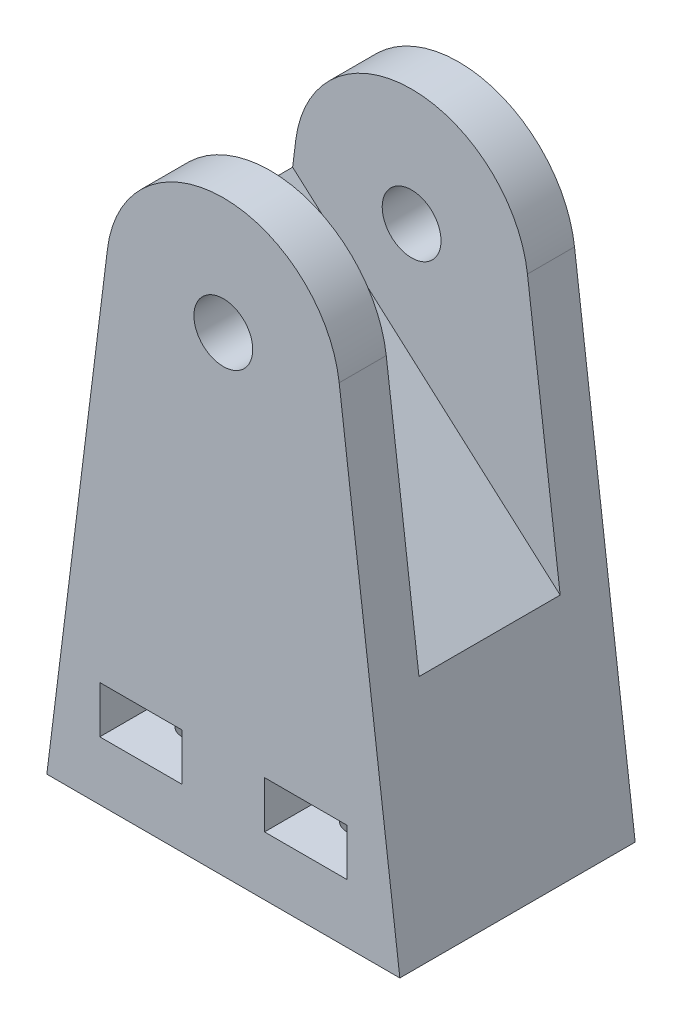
SolidWorks part; units mm, degrees
ref_plane "前视基准面" through (0, 0, 0) normal (0, 0, 1) x (1, 0, 0)
ref_plane "上视基准面" through (0, 0, 0) normal (0, 1, 0) x (1, 0, 0)
ref_plane "右视基准面" through (0, 0, 0) normal (1, 0, 0) x (0, 0, -1)
sketch "草图1" plane through (0, 0, 0) normal (0, 0, 1) x (1, 0, 0)
  line L0 (6, 20) -> (10, 20)
  line L1 (-10, 20) -> (-6, 20)
  line L3 (-10, -20) -> (10, -20)
  line L5 (0, -20) -> (15, -20)
  line L6 (15, -20) -> (10, 20)
  line L7 (-10, -20) -> (-15, -20)
  line L8 (-15, -20) -> (-10, 20)
  circle A0 centre (0, 20) radius 2.5
  arc A1 (6, 20) -> (-6, 20) centre (0, 20) ccw
extrude "凸台-拉伸1" add sketch "草图1" along normal blind 20 contours L0 A1 L1 L8 L7 L3 L5 L6 A0
fillet "圆角1" radius 10 2 edges at (-6, 20, 10) (6, 20, 10)
ref_plane "基准面1" through (0, 13, 0) normal (0, -1, 0) x (-1, 0, 0)
sketch "草图2" plane through (0, 13, 0) normal (0, -1, 0) x (-1, 0, 0)
  line L2 (15, 0) -> (-20.9192, 0)
  line L3 (15, 0) -> (15, -4)
  line L4 (15, -4) -> (-20.9192, -4)
  line L5 (-20.9192, 0) -> (-20.9192, -4)
  line L6 (15, -20) -> (-18.9377, -20)
  line L7 (15, -20) -> (15, -16)
  line L8 (15, -16) -> (-18.9377, -16)
  line L9 (-18.9377, -20) -> (-18.9377, -16)
  line L10 (15, -4) -> (-18.145, -4)
  line L11 (15, -4) -> (15, -8)
  line L12 (15, -8) -> (-18.145, -8)
  line L13 (-18.145, -4) -> (-18.145, -8)
  line L14 (15, -8) -> (-18.9377, -8)
  line L15 (15, -8) -> (15, -12)
  line L16 (15, -12) -> (-18.9377, -12)
  line L17 (-18.9377, -8) -> (-18.9377, -12)
  line L18 (15, -12) -> (-21.6756, -12)
  line L19 (15, -12) -> (15, -16)
  line L20 (15, -16) -> (-21.6756, -16)
  line L21 (-21.6756, -12) -> (-21.6756, -16)
extrude "切除-拉伸1" cut sketch "草图2" against normal blind 33 contours L4 L13 L12 L11 | L18 L21 L20 L8 L19 L16 | L14 L17 L16 L15 L12
sketch "草图6" plane through (0, 0, 20) normal (0, 0, 1) x (1, 0, 0)
  line L0 (-16.3849, -20) -> (-16.3849, -13)
  line L1 (15, -20) -> (-15, -20) construction
  line L2 (0, -13) -> (-7, -13)
  line L3 (-14.125, -13) -> (14.125, -13)
  line L4 (-15, -20) -> (-10, 20) construction
  line L5 (15, -20) -> (10, 20) construction
  line L6 (-7, -13) -> (7, -13)
  line L8 (-10, -11.5) -> (-4, -11.5)
  line L9 (-10, -11.5) -> (-10, -14.5)
  line L10 (-10, -14.5) -> (-4, -14.5)
  line L11 (-4, -11.5) -> (-4, -14.5)
  line L12 (-10, -11.5) -> (-4, -14.5) construction
  line L13 (-10, -14.5) -> (-4, -11.5) construction
  line L14 (4, -11.5) -> (10, -11.5)
  line L15 (4, -11.5) -> (4, -14.5)
  line L16 (4, -14.5) -> (10, -14.5)
  line L17 (10, -11.5) -> (10, -14.5)
  line L18 (4, -11.5) -> (10, -14.5) construction
  line L19 (4, -14.5) -> (10, -11.5) construction
extrude "切除-拉伸2" cut sketch "草图6" against normal through all contours L11 L6 L3 L9 L10 | L11 L8 L9 L3 L6 | L17 L3 L6 L15 L16 | L17 L14 L15 L6 L3
sketch "草图7" plane through (0, -20, 0) normal (0, -1, 0) x (1, 0, 0)
  line L0 (0, 20) -> (7, 20)
  line L1 (15, 20) -> (-15, 20) construction
  line L2 (7, 20) -> (-7, 20)
  line L3 (-7, 20) -> (-7, 0)
  line L4 (15, 0) -> (-15, 0) construction
  line L5 (-7, 10) -> (-7, 15)
  line L6 (-7, 10) -> (-7, 5)
  circle A0 centre (-7, 15) radius 1.5
  circle A1 centre (7, 15) radius 1.5
  circle A2 centre (-7, 5) radius 1.5
  circle A3 centre (7, 5) radius 1.5
extrude "切除-拉伸3" cut sketch "草图7" against normal blind 20 contours L3 A0 | L3 A0 | L6 A2 L3 | L3 A2 L6 | A3 | A1
sketch "草图8" plane through (0, 0, 0) normal (0, 0, -1) x (-1, 0, 0)
  line L0 (-10, 20) -> (-9.8462, 21.2308)
  line L1 (-10, 20) -> (-10.2326, 18.139)
  line L2 (-15, -20) -> (-10, 20) construction
  line L3 (-10.2326, 18.139) -> (-8.6857, 17.6917)
  line L4 (10.2326, 18.139) -> (9.8462, 21.2308)
  line L5 (15, -20) -> (10, 20) construction
  line L6 (10.2326, 18.139) -> (8.3902, 17.345)
  arc A0 (-9.7171, 17.9899) -> (9.7001, 17.9095) centre (0, 20) ccw
  circle A1 centre (0, 20) radius 2.5
  arc A2 (9.8462, 21.2308) -> (-9.8462, 21.2308) centre (0, 20) ccw
extrude "凸台-拉伸3" add sketch "草图8" against normal blind 4
sketch "草图9" plane through (0, 0, 20) normal (0, 0, 1) x (1, 0, 0)
  line L3 (-10.875, 13) -> (10.875, 13)
  line L4 (10.875, 13) -> (9.8462, 21.2308)
  line L5 (-9.8462, 21.2308) -> (-10.875, 13)
  line L6 (-10.875, 13) -> (10.875, 13)
  line L7 (10.875, 13) -> (9.8462, 21.2308)
  line L8 (-9.8462, 21.2308) -> (-10.875, 13)
  circle A0 centre (0, 20) radius 2.5 construction
  arc A1 (9.8462, 21.2308) -> (-9.8462, 21.2308) centre (0, 20) ccw
  arc A2 (9.8462, 21.2308) -> (-9.8462, 21.2308) centre (0, 20) ccw
  circle A3 centre (0, 20) radius 2.5
  dimension "D1" = 0
extrude "凸台-拉伸4" add sketch "草图9" against normal blind 4
sketch "草图10" plane through (0, 0, 4) normal (0, 0, 1) x (1, 0, 0)
  line L0 (-10.875, 13) -> (12.6258, -1.0065)
  line L1 (15, -20) -> (9.8462, 21.2308) construction
  line L5 (15, -20) -> (9.8462, 21.2308)
  line L6 (-9.8462, 21.2308) -> (-15, -20)
  line L7 (-15, -20) -> (15, -20)
  line L8 (15, -20) -> (9.8462, 21.2308)
  line L9 (-9.8462, 21.2308) -> (-15, -20)
  line L10 (-15, -20) -> (15, -20)
  arc A1 (9.8462, 21.2308) -> (-9.8462, 21.2308) centre (0, 20) ccw
  arc A2 (9.8462, 21.2308) -> (-9.8462, 21.2308) centre (0, 20) ccw
  dimension "D1" = 0
extrude "切除-拉伸4" cut sketch "草图10" along normal blind 12 contours L0 L8 M5
sketch "草图12" plane through (0, 0, 4) normal (0, 0, 1) x (1, 0, 0)
  line L0 (12.6258, -1.0065) -> (-10.1103, 19.1175)
  line L1 (-15, -20) -> (-9.8462, 21.2308) construction
  line L5 (-9.8462, 21.2308) -> (-10.875, 13)
  line L6 (-10.875, 13) -> (12.6258, -1.0065)
  line L7 (12.6258, -1.0065) -> (9.8462, 21.2308)
  line L8 (-9.8462, 21.2308) -> (-10.875, 13)
  line L9 (-10.875, 13) -> (12.6258, -1.0065)
  line L10 (12.6258, -1.0065) -> (9.8462, 21.2308)
  arc A1 (9.8462, 21.2308) -> (-9.8462, 21.2308) centre (0, 20) ccw
  arc A2 (9.8462, 21.2308) -> (-9.8462, 21.2308) centre (0, 20) ccw
  dimension "D1" = 0
extrude "凸台-拉伸6" add sketch "草图12" along normal blind 12 contours L0 M2 M1
sketch "草图13" plane through (0, 0, 0) normal (0, 0, -1) x (-1, 0, 0)
  line L1 (-10, -11.5) -> (-10.5, -11.5)
  line L2 (-10, -11.5) -> (-10, -11)
  line L3 (-10, -11) -> (-10.5, -11)
  line L4 (-10.5, -11.5) -> (-10.5, -11)
  line L5 (-10.5, -11) -> (-3.5, -11)
  line L6 (-10.5, -11) -> (-10.5, -15)
  line L7 (-10.5, -15) -> (-3.5, -15)
  line L8 (-3.5, -11) -> (-3.5, -15)
  line L9 (4, -11.5) -> (3.5, -11.5)
  line L10 (4, -11.5) -> (4, -11)
  line L11 (4, -11) -> (3.5, -11)
  line L12 (3.5, -11.5) -> (3.5, -11)
  line L13 (3.5, -11) -> (10.5, -11)
  line L14 (3.5, -11) -> (3.5, -15)
  line L15 (3.5, -15) -> (10.5, -15)
  line L16 (10.5, -11) -> (10.5, -15)
extrude "切除-拉伸5" cut sketch "草图13" against normal blind 24 contours M9 M12 M11 M10 | M5 M8 M7 M6 | L16 L13 L10 L9 L14 L15 M6 M7 M8 M5 | L12 L9 L10 L11 | L8 L5 L2 L1 L6 L7 M10 M11 M12 M9 | L4 L1 L2 L3
